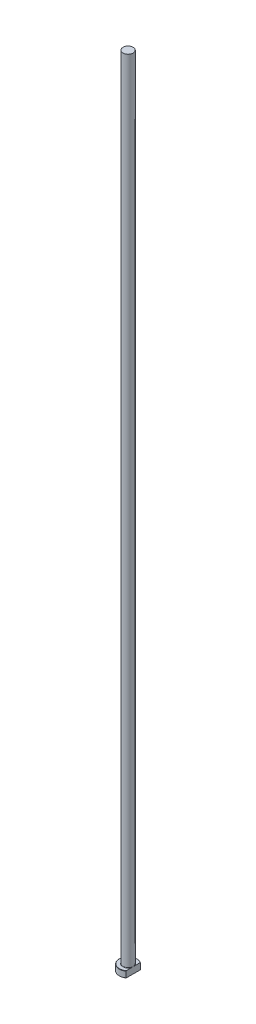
SolidWorks part; units mm, degrees
ref_plane "Front Plane" through (0, 0, 0) normal (0, 0, 1) x (1, 0, 0)
ref_plane "Top Plane" through (0, 0, 0) normal (0, 1, 0) x (1, 0, 0)
ref_plane "Right Plane" through (0, 0, 0) normal (1, 0, 0) x (0, 0, -1)
sketch "Sketch1" plane through (0, 0, 0) normal (0, 0, 1) x (1, 0, 0)
  line L0 (0, 259.9588) -> (0, -15.1925) construction
  line L1 (0, 0) -> (-7, 0)
  line L2 (-7, 0) -> (-7, 5)
  line L3 (-7, 5) -> (-4, 5)
  line L4 (-4, 5) -> (-4, 630)
  line L5 (-4, 630) -> (0, 630)
  line L6 (0, 630) -> (0, 0)
  dimension "L" = 630
  dimension "H" = 14
  dimension "T" = 5
  dimension "D" = 8
revolve "Revolve1" add sketch "Sketch1" angle 360 about L0
chamfer "Chamfer1" distance 0.2 angle 45 2 edges at (0, 5, 7) (0, 0, 7)
fillet "Fillet1" radius 0.2 1 edges at (0, 5, 4)
sketch "Sketch2" plane through (0, 0, 0) normal (0, 1, 0) x (1, 0, 0)
  line L0 (4, 5.7446) -> (4, -5.7446)
  circle A0 centre (0, 0) radius 7 construction
  arc A1 (4, -5.7446) -> (4, 5.7446) centre (0, 0) ccw
  circle A2 centre (0, 0) radius 4 construction
extrude "KEY" cut sketch "Sketch2" along normal through all
